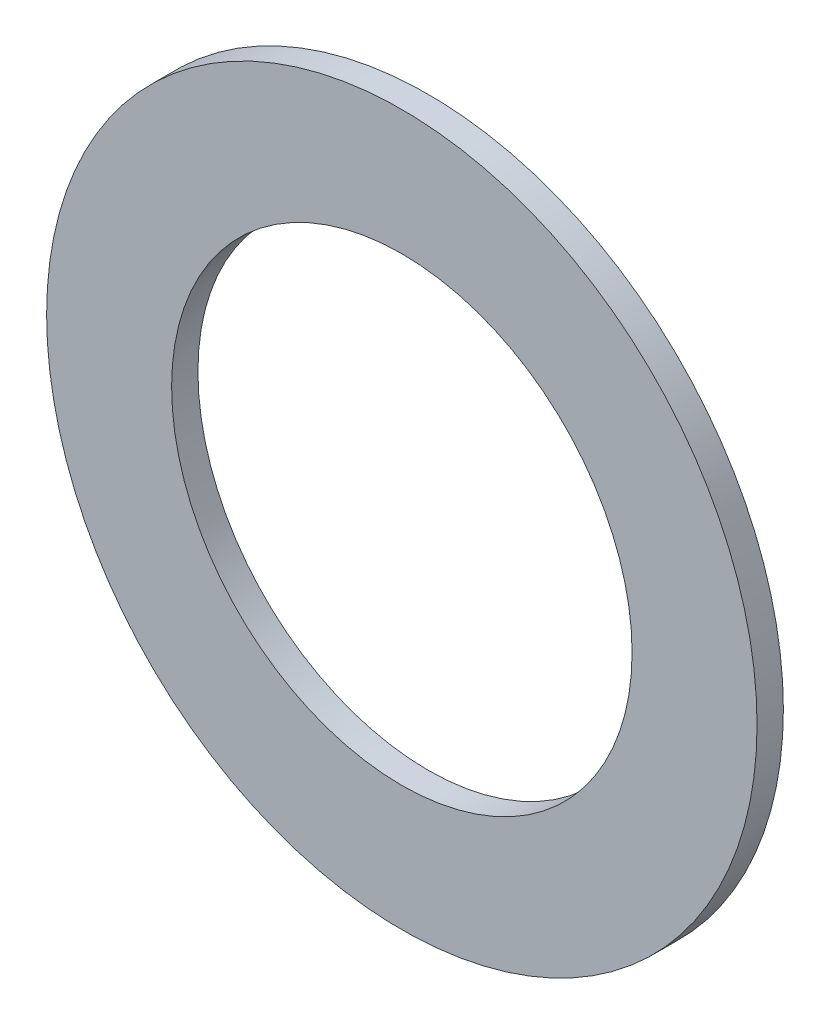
SolidWorks part; units mm, degrees
ref_plane "前视基准面" through (0, 0, 0) normal (0, 0, 1) x (1, 0, 0)
ref_plane "上视基准面" through (0, 0, 0) normal (0, 1, 0) x (1, 0, 0)
ref_plane "右视基准面" through (0, 0, 0) normal (1, 0, 0) x (0, 0, -1)
sketch "草图1" plane through (0, 0, 2) normal (0, 0, -1) x (-1, 0, 0)
  circle A0 centre (-3, 52) radius 17.5
  circle A1 centre (-3, 52) radius 27
  dimension "D1" = 35
  dimension "D2" = 54
extrude "拉伸1" add sketch "草图1" along normal blind 2
